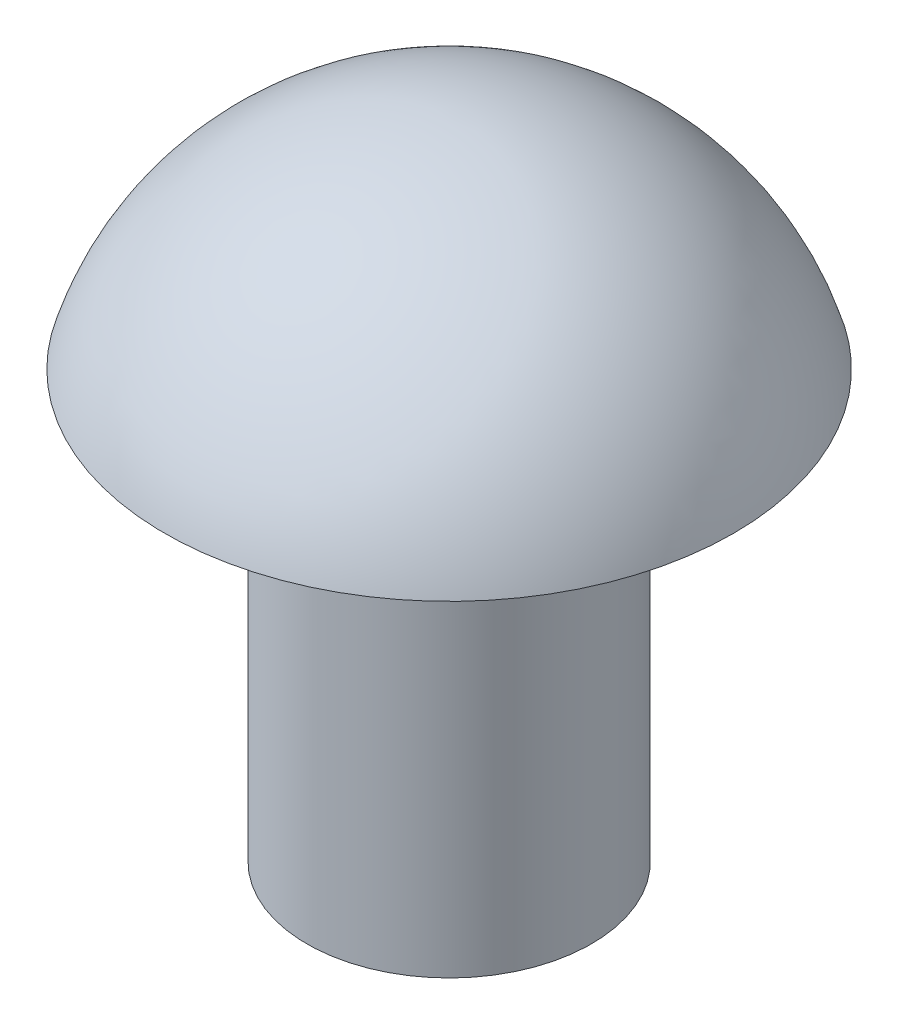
SolidWorks part; units mm, degrees
ref_plane "Face" through (0, 0, 0) normal (0, 0, 1) x (1, 0, 0)
ref_plane "Dessus" through (0, 0, 0) normal (0, 1, 0) x (1, 0, 0)
ref_plane "Droite" through (0, 0, 0) normal (1, 0, 0) x (0, 0, -1)
sketch "Esquisse1" plane through (0, 0, 0) normal (0, 0, 1) x (1, 0, 0)
  line L0 (2, 3) -> (1, 3)
  line L1 (0, 0) -> (1, 0)
  line L2 (0, 0) -> (0, 4.5)
  line L3 (0, 0) -> (0, 6.5666) construction
  line L4 (1, 0) -> (1, 3)
  arc A0 (2, 3) -> (0, 4.5) centre (0, 2.4167) ccw
  dimension "D1" = 1
  dimension "D2" = 2
  dimension "D3" = 4.5
  dimension "D4" = 3
revolve "Base-Révolution" add sketch "Esquisse1" angle 360 about L3
